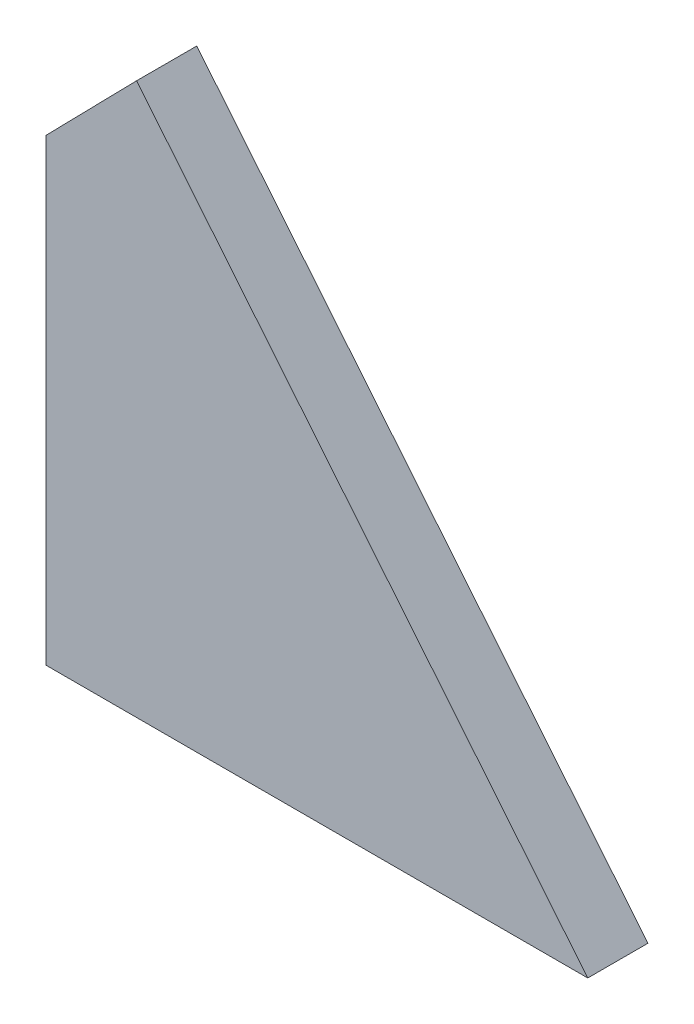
SolidWorks part; units mm, degrees
ref_plane "Plan de face" through (0, 0, 0) normal (0, 0, 1) x (1, 0, 0)
ref_plane "Plan de dessus" through (0, 0, 0) normal (0, 1, 0) x (1, 0, 0)
ref_plane "Plan de droite" through (0, 0, 0) normal (1, 0, 0) x (0, 0, -1)
sketch "Esquisse1" plane through (0, 0, 0) normal (0, 0, 1) x (1, 0, 0)
  line L0 (0, 0) -> (0, 88)
  line L1 (0, 88) -> (72, 0)
  line L2 (72, 0) -> (0, 0)
  dimension "D1" = 72
  dimension "D2" = 88
extrude "Extrusion1" add sketch "Esquisse1" along normal blind 8
sketch "Esquisse2" plane through (0, 0, 8) normal (0, 0, 1) x (1, 0, 0)
  line L0 (0, 88) -> (0, 61)
  line L1 (0, 88) -> (0, 0) construction
  line L2 (0, 61) -> (12.0315, 73.2948)
  line L3 (72, 0) -> (0, 88) construction
  line L4 (12.0315, 73.2948) -> (0, 88)
  dimension "D1" = 27
  dimension "D2" = 19
extrude "Enlèv. mat.-Extru.1" cut sketch "Esquisse2" against normal blind 8
